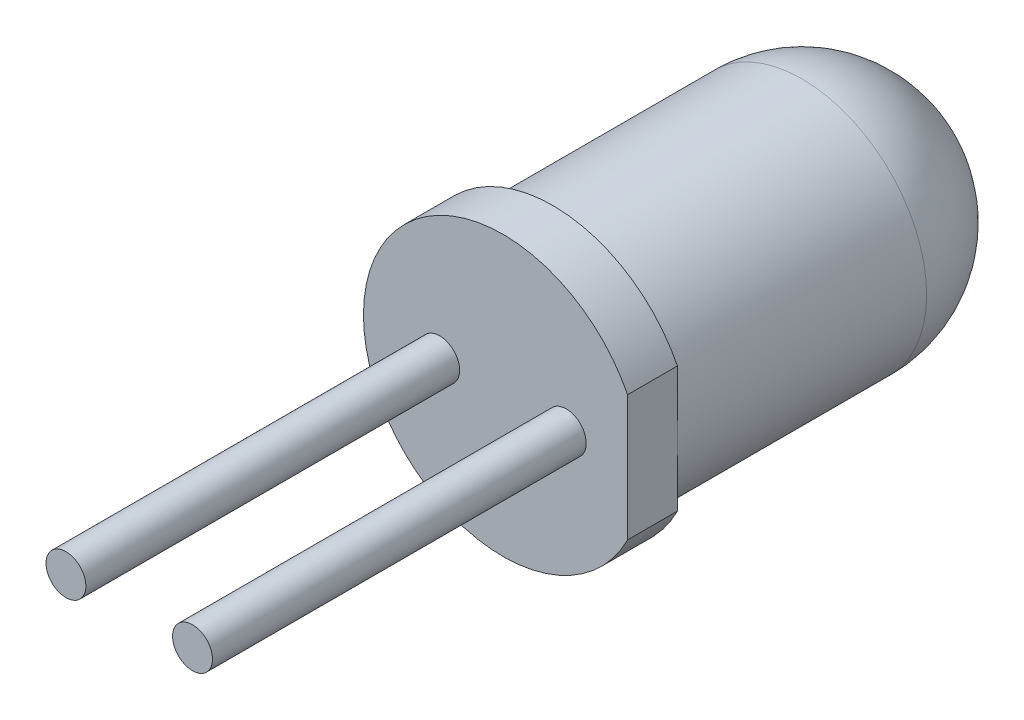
SolidWorks part; units mm, degrees
ref_plane "Face" through (0, 0, 0) normal (0, 0, 1) x (1, 0, 0)
ref_plane "Dessus" through (0, 0, 0) normal (0, 1, 0) x (1, 0, 0)
ref_plane "Droite" through (0, 0, 0) normal (1, 0, 0) x (0, 0, -1)
sketch "Esquisse1" plane through (0, 0, 0) normal (0, 0, 1) x (1, 0, 0)
  circle A0 centre (0, 0) radius 2.5
extrude "Base-Extrusion" add sketch "Esquisse1" along normal blind 8.5
sketch "Esquisse2" plane through (0, 0, 8.5) normal (0, 0, 1) x (1, 0, 0)
  line L0 (2.5, -2.4917) -> (2.5, 2.5621) construction
  line L1 (2.5, 1.261) -> (2.5, -1.261)
  arc A0 (2.5, 1.261) -> (2.5, -1.261) centre (0, 0) ccw
extrude "Boss.-Extru.1" add sketch "Esquisse2" against normal blind 1
fillet "Congé1" radius 2.5 1 edges at (2.5, 0, 0)
sketch "Esquisse3" plane through (0, 0, 8.5) normal (0, 0, 1) x (1, 0, 0)
  line L0 (2.8791, 0) -> (-3.5821, 0) construction
  line L1 (0, -2.9335) -> (0, 2.9813) construction
  line L2 (1.27, -0.8777) -> (1.27, 1.5607) construction
  circle A0 centre (1.27, 0) radius 0.4
  circle A1 centre (-1.27, 0) radius 0.4
  dimension "D1" = 1.27
extrude "Extrusion1" add sketch "Esquisse3" along normal blind 7.5
